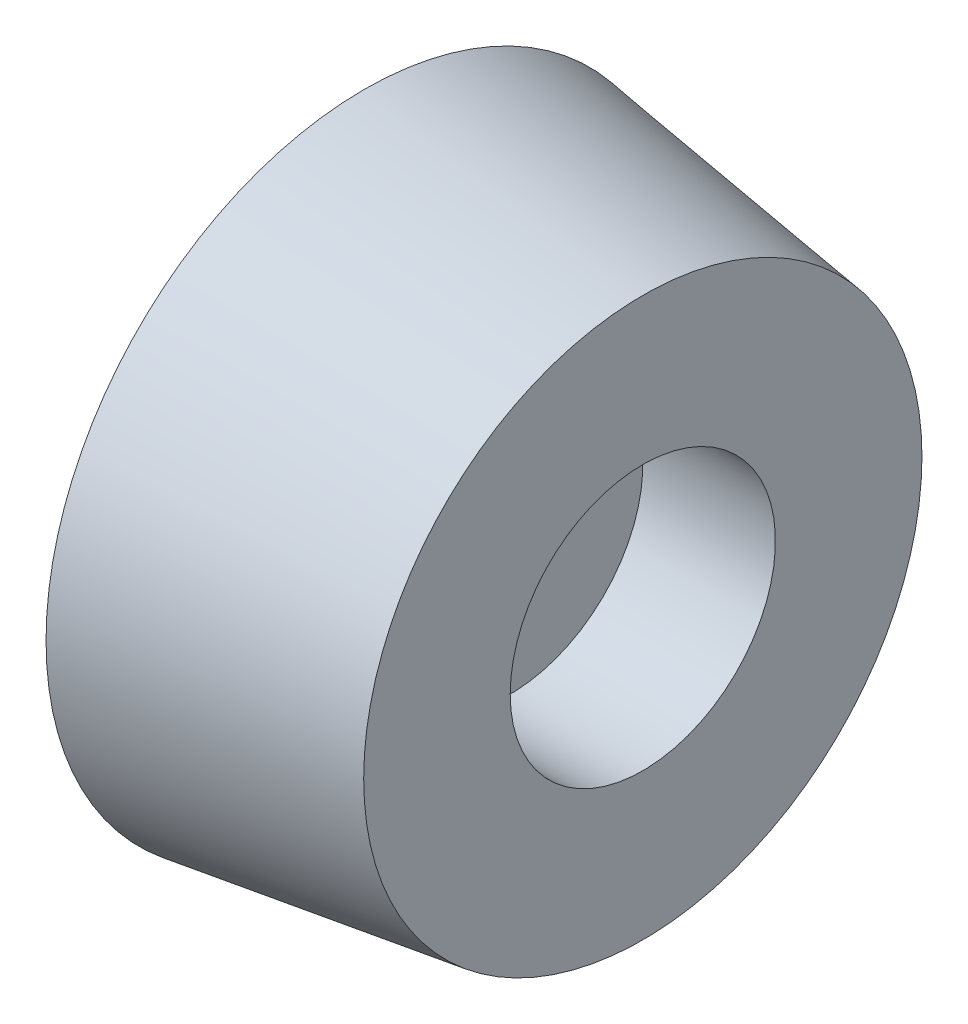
SolidWorks part; units mm, degrees
ref_plane "Přední" through (0, 0, 0) normal (0, 0, 1) x (1, 0, 0)
ref_plane "Horní" through (0, 0, 0) normal (0, 1, 0) x (1, 0, 0)
ref_plane "Pravá" through (0, 0, 0) normal (1, 0, 0) x (0, 0, -1)
sketch "Skica1" plane through (0, 0, 0) normal (0, 0, 1) x (1, 0, 0)
  line L0 (0, 0) -> (11.6167, 0) construction
  line L1 (-1, 10.4853) -> (-1, 1.5)
  line L2 (-1, 1.5) -> (4.5, 1.5)
  line L3 (4.5, 1.5) -> (4.5, 5)
  line L4 (-1, 10.4853) -> (-1, 12)
  line L5 (-1, 12) -> (9.5, 10.5243)
  line L6 (9.5, 10.5243) -> (9.5, 5)
  line L7 (9.5, 5) -> (4.5, 5)
  dimension "D1" = 24
  dimension "D2" = 5
  dimension "D3" = 10.5
  dimension "D4" = 1.5
  dimension "D6" = 10
  dimension "D7" = 8
revolve "Rotovat1" add sketch "Skica1" angle 360 about L0
